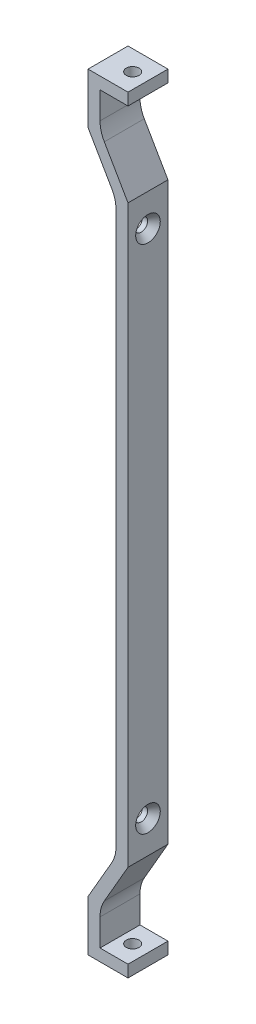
SolidWorks part; units mm, degrees
ref_plane "Front Plane" through (0, 0, 0) normal (0, 0, 1) x (1, 0, 0)
ref_plane "Top Plane" through (0, 0, 0) normal (0, 1, 0) x (1, 0, 0)
ref_plane "Right Plane" through (0, 0, 0) normal (1, 0, 0) x (0, 0, -1)
sketch "Sketch1" plane through (0, 0, 0) normal (0, 0, 1) x (1, 0, 0)
  line L1 (-7.9375, 152.4) -> (7.9375, 152.4)
  line L2 (-7.9375, 152.4) -> (-7.9375, -152.4)
  line L3 (-7.9375, -152.4) -> (7.9375, -152.4)
  line L4 (7.9375, 152.4) -> (7.9375, -152.4)
  point P4 (7.9375, 0)
  point P6 (0, 152.4)
  dimension "D1" = 15.875
  dimension "D2" = 304.8
extrude "Extrude1" add sketch "Sketch1" along normal mid plane 15.875
sketch "Sketch2" plane through (0, 0, 7.9375) normal (0, 0, 1) x (1, 0, 0)
  line L0 (7.9375, -152.4) -> (7.9375, 152.4) construction
  line L1 (7.9375, 147.6375) -> (-3.175, 147.6375)
  line L2 (-3.175, 147.6375) -> (-3.175, 133.5474)
  line L3 (-3.175, 133.5474) -> (7.9375, 114.3)
  line L4 (7.9375, 152.4) -> (-7.9375, 152.4)
  line L5 (7.9375, 152.4) -> (-7.9375, 152.4) construction
  line L6 (-7.9375, 152.4) -> (-7.9375, -152.4) construction
  line L7 (-7.9375, 152.4) -> (-7.9375, 132.2713)
  line L8 (-7.9375, 132.2713) -> (3.175, 113.0239)
  line L9 (3.175, 113.0239) -> (3.175, -113.0239)
  line L10 (-7.9375, 132.2713) -> (3.8131, 111.9188) construction
  line L12 (7.9375, 152.4) -> (7.9375, 147.6375)
  line L13 (7.9375, 114.3) -> (7.9375, -114.3)
  line L14 (7.9375, -152.4) -> (7.9375, -147.6375)
  line L15 (7.9375, -147.6375) -> (-3.175, -147.6375)
  line L16 (7.9375, -152.4) -> (-7.9375, -152.4)
  line L17 (-3.175, -147.6375) -> (-3.175, -133.5474)
  line L18 (-7.9375, -152.4) -> (-7.9375, -132.2713)
  line L19 (-7.9375, -132.2713) -> (3.175, -113.0239)
  line L20 (-3.175, -133.5474) -> (7.9375, -114.3)
  point P28 (7.9375, 0)
  dimension "D1" = 4.7625
  dimension "D2" = 4.7625
  dimension "D3" = 38.1
  dimension "D4" = 150
  dimension "D5" = 4.7625
  dimension "D6" = 4.7625
  dimension "D7" = 4.7625
  dimension "D8" = 4.7625
  dimension "D9" = 152.4
  dimension "D10" = 15.875
  dimension "D11" = 226.0478
  dimension "D12" = 39.3761
  dimension "D13" = 4.7625
extrude "Cut-Extrude1" cut sketch "Sketch2" against normal blind 15.875 flip side to cut
sketch "Sketch4" plane through (0, 152.4, 0) normal (0, 1, 0) x (-1, 0, 0)
  line L0 (-7.9375, 7.9375) -> (-7.9375, -7.9375) construction
  circle A0 centre (-1.8415, 0) radius 2.54
  dimension "D1" = 6.096
  dimension "D2" = 5.08
extrude "Cut-Extrude2" cut sketch "Sketch4" against normal blind 4.7625
mirror "Mirror3" about plane through (0, 0, 0) normal (0, 1, 0) of "Cut-Extrude2"
sketch "Sketch5" plane through (7.9375, 0, 0) normal (1, 0, 0) x (0, 0, -1)
  line L0 (-7.9375, -152.4) -> (7.9375, -152.4) construction
  line L1 (-7.9375, -114.3) -> (-7.9375, 114.3) construction
  circle A0 centre (0, -101.473) radius 2.413
  dimension "D1" = 4.826
  dimension "D3" = 7.9375
  dimension "D2" = 50.927
extrude "Cut-Extrude3" cut sketch "Sketch5" against normal through all
fillet "Fillet4" radius 12.7 4 edges at (-3.175, -133.5474, 0) (-3.175, 133.5474, 0) (3.175, 113.0239, 0) (3.175, -113.0239, 0)
mirror "Mirror4" about plane through (0, 0, 0) normal (0, 1, 0) of "Cut-Extrude3"
hole_wizard "CSK for #10 Flat Head Machine Screw2" positions "Sketch8" profile "Sketch7" countersink size "#10" standard "Ansi Inch"
sketch "Sketch8" plane through (7.9375, 0, 0) normal (1, 0, 0) x (0, 0, -1)
  circle A0 centre (0, -101.473) radius 2.413 construction
  point P0 (0, -101.473)
  point P1 (0, 101.473)
sketch "Sketch7" plane through (7.9375, -101.473, 0) normal (0, 1, 0) x (0, 0, -1)
  line L0 (0, 0) -> (0, 15.875)
  line L1 (0, 15.875) -> (2.5527, 15.875)
  line L2 (2.5527, 15.875) -> (2.5527, 2.6882)
  line L3 (2.5527, 2.6882) -> (4.8895, 0)
  line L5 (4.8895, 0) -> (0, 0)
  line L6 (-2.5527, 2.6882) -> (-4.8895, 0) construction
  line L11 (0, -6.35) -> (0, 107.95) construction
  dimension "Thru Hole Dia." = 5.1054
  dimension "Thru Hole Depth" = 15.875
  dimension "Near C'Sink Dia." = 9.779
  dimension "Near C'Sink Angle" = 82
